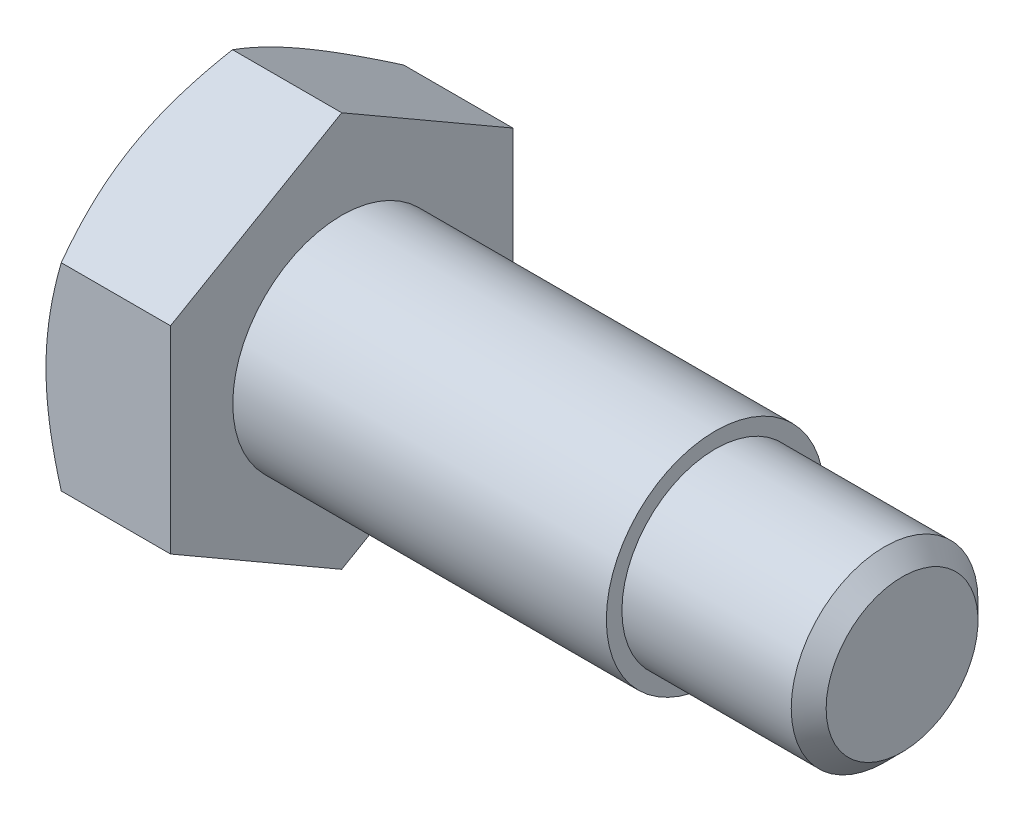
SolidWorks part; units mm, degrees
ref_plane "Plane1" through (0, 0, 0) normal (0, 0, 1) x (1, 0, 0)
ref_plane "Plane2" through (0, 0, 0) normal (0, 1, 0) x (1, 0, 0)
ref_plane "Plane3" through (0, 0, 0) normal (1, 0, 0) x (0, 0, -1)
extrude "BaseHead" add sketch "Sketch1" along normal blind 2
sketch "Sketch1" plane through (0, 0, 0) normal (1, 0, 0) x (0, 0, -1)
  line L0 (2.75, 1.5877) -> (2.75, -1.5877)
  line L1 (-2.75, 1.5877) -> (-2.75, -1.5877)
  line L2 (2.75, -1.5877) -> (0, -3.1754)
  line L3 (0, -3.1754) -> (-2.75, -1.5877)
  line L4 (2.75, 1.5877) -> (0, 3.1754)
  line L5 (0, 3.1754) -> (-2.75, 1.5877)
  dimension "Width_flats" = 5.5
  dimension "D2" = 120
  dimension "D3" = 2.75
  dimension "D4" = 2.75
  dimension "D5" = 2.75
revolve "BaseBody" add sketch "BodySke" angle 360 about L7
sketch "BodySke" plane through (0, 0, 0) normal (0, 0, 1) x (1, 0, 0)
  line L1 (0, 0) -> (11, 0)
  line L2 (0, 0) -> (0, 1.5)
  line L4 (11, 0) -> (11, 1.2195)
  line L5 (2, 3.1754) -> (2, 1.5877) construction
  line L6 (11, 1.2195) -> (10.7195, 1.5)
  line L7 (0, 0) -> (110.49, 0) construction
  line L8 (11, -1.2195) -> (10.7195, -1.5) construction
  line L9 (0, 1.5877) -> (0, -1.5877) construction
  line L10 (2.5, 15.24) -> (2.5, -1.27) construction
  line L11 (9, 15.24) -> (9, -1.27) construction
  line L12 (2, 1.5877) -> (2, -1.5877) construction
  line L15 (0, 1.5) -> (10.7195, 1.5)
  dimension "Length" = 9
  dimension "Body_ch_ang" = 45
  dimension "Diameter" = 3
  dimension "Minor_dia" = 2.439
  dimension "Advance" = 0.5
  dimension "Thread_nom" = 2
fillet "HeadFillet" [suppressed] radius 0.1
sketch "Sketch3" plane through (0, 0, 0) normal (0, 0, 1) x (1, 0, 0)
  line L0 (0, 2.75) -> (3.1324, 8.1754)
  line L1 (0, 3.1754) -> (0, 1.5877) construction
  line L2 (3.1324, 8.1754) -> (3.1324, 13.1754)
  line L3 (3.1324, 13.1754) -> (-10, 13.1754)
  line L4 (-10, 13.1754) -> (-10, 2.75)
  line L5 (-10, 2.75) -> (0, 2.75)
  line L6 (0, 0) -> (99.06, 0) construction
  line L7 (2, 3.1754) -> (0, 3.1754) construction
  dimension "D1" = 2.75
  dimension "D2" = 5
  dimension "D3" = 10
  dimension "D4" = 5
  dimension "Head_ch_ang" = 30
revolve "HeadChamfer" cut sketch "Sketch3" angle 360 about L6
sketch "ThdSchSke" plane through (0, 0, 0) normal (0, 0, 1) x (1, 0, 0)
  line L0 (9, -1.2195) -> (8.8036, -1.5)
  line L1 (9, -1.2195) -> (9.1964, -1.5)
  line L2 (9.1964, -1.5) -> (9.1964, -1.875)
  line L3 (-3.175, 0) -> (5.1513, 0) construction
  line L5 (9.1964, -1.875) -> (8.8036, -1.875)
  line L6 (8.8036, -1.875) -> (8.8036, -1.5)
  dimension "Thread_minor" = 2.439
  dimension "Diameter" = 3
  dimension "Start" = 9
  dimension "SideAngle" = 55
  dimension "VeeAngle" = 70
  dimension "Overcut" = 3.75
revolve "ThreadSchematic" [suppressed] cut sketch "ThdSchSke" angle 360 about L3
pattern_linear "ThdSchPat" [suppressed]
sketch "Esquisse1" plane through (2, 0, 0) normal (1, 0, 0) x (0, 0, -1)
  circle A0 centre (0, 0) radius 1.75
  dimension "D1" = 3.5
extrude "Extrusion1" add sketch "Esquisse1" along normal blind 6
equation "\"D3@Sketch1\" = \"Width_flats@Sketch1\" / 2"
equation "\"D4@Sketch1\" = \"D3@Sketch1\""
equation "\"D5@Sketch1\" = \"D4@Sketch1\""
equation "\"Thread_minor@ThreadCosmetic\" = \"Minor_dia@BodySke\""
equation "\"D1@Sketch3\" = \"Width_flats@Sketch1\" / 2"
equation "\"Thread_length@ThreadCosmetic\" = ((sgn( (\"Length@BodySke\" - \"Advance@BodySke\" ) - \"Thread_nom@BodySke\" )-1)*( (\"Length@BodySke\" - \"Advance@BodySke\" ) - \"Thread_nom@BodySke\" ))/-2+ \"Thread_nom@BodySke\""
equation "\"Thread_minor@ThdSchSke\" = \"Minor_dia@BodySke\""
equation "\"Diameter@ThdSchSke\" = \"Diameter@BodySke\""
equation "\"Overcut@ThdSchSke\" = \"Diameter@BodySke\" * 1.25"
equation "\"Start@ThdSchSke\" = \"Head_ht@BaseHead\" + \"Length@BodySke\" - \"Thread_length@ThreadCosmetic\"  '---Non-countersunk---"
equation "\"Num_threads@ThdSchPat\" = int( \"Thread_length@ThreadCosmetic\" / \"Advance@BodySke\" + 0.999 )  + 1"
equation "\"Advance@ThdSchPat\" = \"Thread_length@ThreadCosmetic\" /  (\"Num_threads@ThdSchPat\" - 1) 'relax it"
equation "\"Num_threads@ThdSchPat\" = \"Num_threads@ThdSchPat\" - sgn( \"Num_threads@ThdSchPat\" - 1) '---chamfered tips only---"
